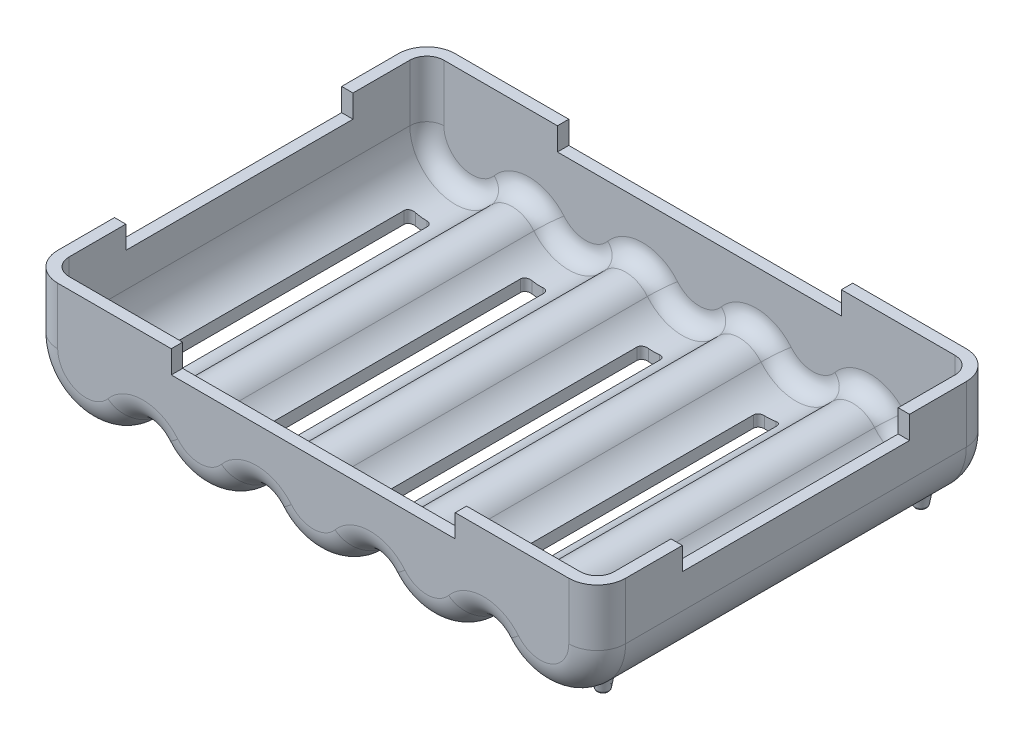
SolidWorks part; units mm, degrees
ref_plane "Front Plane" through (0, 0, 0) normal (0, 0, 1) x (1, 0, 0)
ref_plane "Top Plane" through (0, 0, 0) normal (0, 1, 0) x (1, 0, 0)
ref_plane "Right Plane" through (0, 0, 0) normal (1, 0, 0) x (0, 0, -1)
sketch "Sketch1" plane through (0, 0, 0) normal (0, 0, 1) x (1, 0, 0)
  line L0 (-25, 0) -> (25, 0)
  line L1 (-25, 0) -> (-25, -5)
  line L2 (25, 0) -> (25, -5)
  line L3 (0, 0) -> (0, -5) construction
  arc A0 (-25, -5) -> (-16.1538, -8.1949) centre (-20, -5) ccw
  arc A1 (6.1538, -8.1949) -> (13.8462, -8.1949) centre (10, -5) ccw
  arc A2 (-13.8462, -8.1949) -> (-6.1538, -8.1949) centre (-10, -5) ccw
  arc A3 (-3.8462, -8.1949) -> (3.8462, -8.1949) centre (0, -5) ccw
  arc A4 (16.1538, -8.1949) -> (25, -5) centre (20, -5) ccw
  arc A5 (-13.8462, -8.1949) -> (-16.1538, -8.1949) centre (-15, -9.1533) ccw
  arc A6 (-3.8462, -8.1949) -> (-6.1538, -8.1949) centre (-5, -9.1533) ccw
  arc A7 (6.1538, -8.1949) -> (3.8462, -8.1949) centre (5, -9.1533) ccw
  arc A8 (16.1538, -8.1949) -> (13.8462, -8.1949) centre (15, -9.1533) ccw
  dimension "D3" = 5
  dimension "D4" = 1.5
  dimension "D1" = 50
  dimension "D2" = 5
extrude "Boss-Extrude1" add sketch "Sketch1" along normal mid plane 35
fillet "Fillet1" radius 2.5 22 edges at (-25, -2.5, 17.5) (-21.6984, -9.7027, 17.5) (-15, -7.6533, 17.5) (25, -2.5, 17.5) (21.6984, -9.7027, 17.5) (15, -7.6533, 17.5) (10, -10, 17.5) (5, -7.6533, 17.5) (0, -10, 17.5) (-5, -7.6533, 17.5) (-25, -2.5, -17.5) (-21.6984, -9.7027, -17.5) (-15, -7.6533, -17.5) (-10, -10, -17.5) (-5, -7.6533, -17.5) (0, -10, -17.5) (5, -7.6533, -17.5) (10, -10, -17.5) (15, -7.6533, -17.5) (25, -2.5, -17.5) (-10, -10, 17.5) (21.6984, -9.7027, -17.5)
shell "Shell1" thickness 1
sketch "Sketch2" plane through (0, 0, 17.5) normal (0, 0, 1) x (1, 0, 0)
  line L1 (-12.5, 0) -> (12.5, 0)
  line L2 (-12.5, 0) -> (-12.5, -2)
  line L3 (-12.5, -2) -> (12.5, -2)
  line L4 (12.5, 0) -> (12.5, -2)
  point P6 (0, 0)
  point P8 (0, 0)
  dimension "D1" = 25
  dimension "D2" = 2
extrude "Cut-Extrude1" cut sketch "Sketch2" against normal through all
sketch "Sketch6" plane through (25, 0, 0) normal (1, 0, 0) x (0, 0, -1)
  line L0 (-15, 0) -> (15, 0) construction
  line L1 (-10, 0) -> (10, 0)
  line L2 (-10, 0) -> (-10, -2)
  line L3 (-10, -2) -> (10, -2)
  line L4 (10, 0) -> (10, -2)
  point P6 (0, 0)
  dimension "D1" = 20
  dimension "D2" = 2
extrude "Cut-Extrude2" cut sketch "Sketch6" against normal through all
sketch "Sketch7" plane through (0, 0, 0) normal (0, 1, 0) x (1, 0, 0)
  line L0 (-12.5, 17.5) -> (-22.5, 17.5) construction
  line L1 (-21, 12.5) -> (-20, 12.5)
  line L2 (-21.5, 12) -> (-21.5, -12)
  line L3 (-21, -12.5) -> (-20, -12.5)
  line L4 (-19.5, 12) -> (-19.5, -12)
  line L5 (-25, -10) -> (-25, 10) construction
  arc A0 (-21.5, -12) -> (-21, -12.5) centre (-21, -12) ccw
  arc A1 (-20, -12.5) -> (-19.5, -12) centre (-20, -12) ccw
  arc A2 (-21, 12.5) -> (-21.5, 12) centre (-21, 12) ccw
  arc A3 (-20, 12.5) -> (-19.5, 12) centre (-20, 12) cw
  point P10 (-21.5, -12.5)
  point P15 (-21.5, 12.5)
  point P18 (-19.5, 12.5)
  dimension "D5" = 0.5
  dimension "D1" = 25
  dimension "D2" = 5
  dimension "D3" = 3.5
  dimension "D4" = 2
extrude "Cut-Extrude3" cut sketch "Sketch7" against normal through all
pattern_linear "LPattern1" count 5 spacing 10.25 along (1, 0, 0) of "Cut-Extrude3"
ref_plane "Plane1" through (0, -10.5, 0) normal (0, 1, 0) x (1, 0, 0)
sketch "Sketch5" plane through (0, -10.5, 0) normal (0, 1, 0) x (1, 0, 0)
  line L0 (-12.5, -17.5) -> (-22.5, -17.5) construction
  line L3 (-25, -15) -> (-25, -10) construction
  circle A0 centre (-22, -14) radius 0.5
  dimension "D1" = 1
  dimension "D2" = 3.5
  dimension "D3" = 3
extrude "Boss-Extrude2" add sketch "Sketch5" along normal up to next draft 10
fillet "Fillet2" radius 0.25 1 edges at (-22, -10.5, 14.5)
pattern_linear "LPattern2" count 2 spacing 44 along (1, 0, 0) count 2 spacing 28 along (0, 0, -1) of "Boss-Extrude2", "Fillet2"
